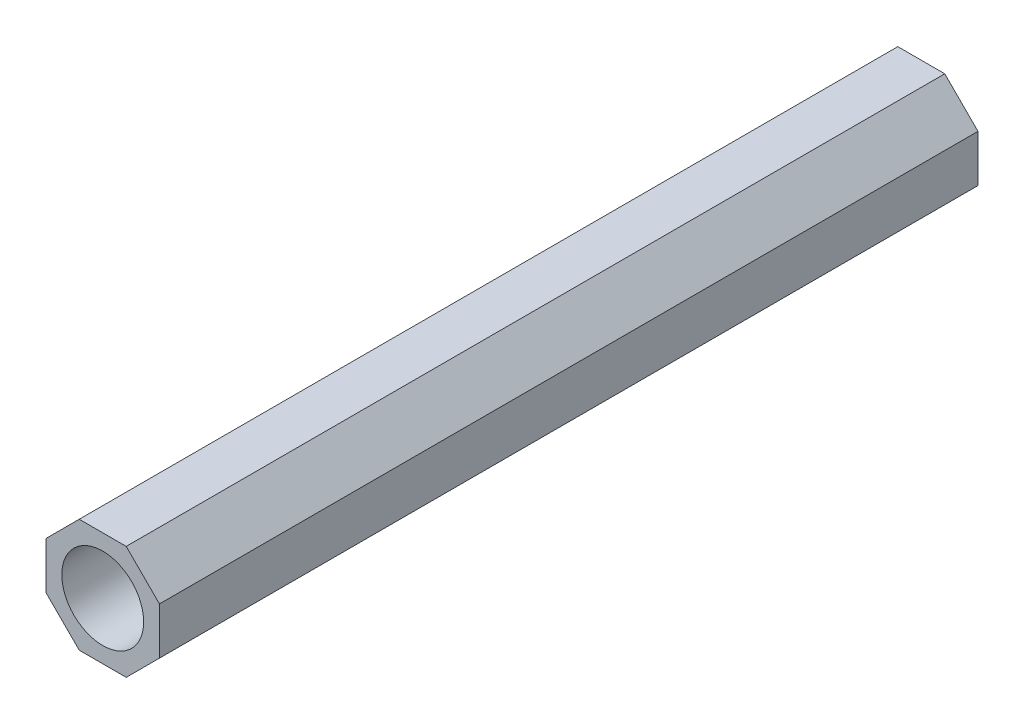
SolidWorks part; units mm, degrees
ref_plane "Front Plane" through (0, 0, 0) normal (0, 0, 1) x (1, 0, 0)
ref_plane "Top Plane" through (0, 0, 0) normal (0, 1, 0) x (1, 0, 0)
ref_plane "Right Plane" through (0, 0, 0) normal (1, 0, 0) x (0, 0, -1)
sketch "Sketch1" plane through (0, 0, 0) normal (0, 0, 1) x (1, 0, 0)
  line L8 (-301.1549, 8.8) -> (-308.4451, 8.8)
  line L9 (-308.4451, 8.8) -> (-313.6, 3.6451)
  line L10 (-313.6, 3.6451) -> (-313.6, -3.6451)
  line L11 (-313.6, -3.6451) -> (-308.4451, -8.8)
  line L12 (-308.4451, -8.8) -> (-301.1549, -8.8)
  line L13 (-301.1549, -8.8) -> (-296, -3.6451)
  line L14 (-296, -3.6451) -> (-296, 3.6451)
  line L15 (-296, 3.6451) -> (-301.1549, 8.8)
  line L16 (-301.1549, 8.8) -> (-308.4451, 8.8)
  line L17 (-308.4451, 8.8) -> (-313.6, 3.6451)
  line L18 (-313.6, 3.6451) -> (-313.6, -3.6451)
  line L19 (-313.6, -3.6451) -> (-308.4451, -8.8)
  line L20 (-308.4451, -8.8) -> (-301.1549, -8.8)
  line L21 (-301.1549, -8.8) -> (-296, -3.6451)
  line L22 (-296, -3.6451) -> (-296, 3.6451)
  line L23 (-296, 3.6451) -> (-301.1549, 8.8)
  circle A0 centre (0, 0) radius 9.525 construction
  circle A1 centre (-304.8, 0) radius 9.525 construction
  dimension "D1" = 19.05
  dimension "D2" = 0
extrude "Extrude1" add sketch "Sketch1" along normal blind 127
sketch "Sketch2" plane through (0, 0, 127) normal (0, 0, 1) x (1, 0, 0)
  circle A0 centre (-304.8, 0) radius 6.35
  circle A1 centre (-304.8, 0) radius 9.525 construction
  dimension "D1" = 12.7
extrude "Cut-Extrude1" cut sketch "Sketch2" against normal through all
